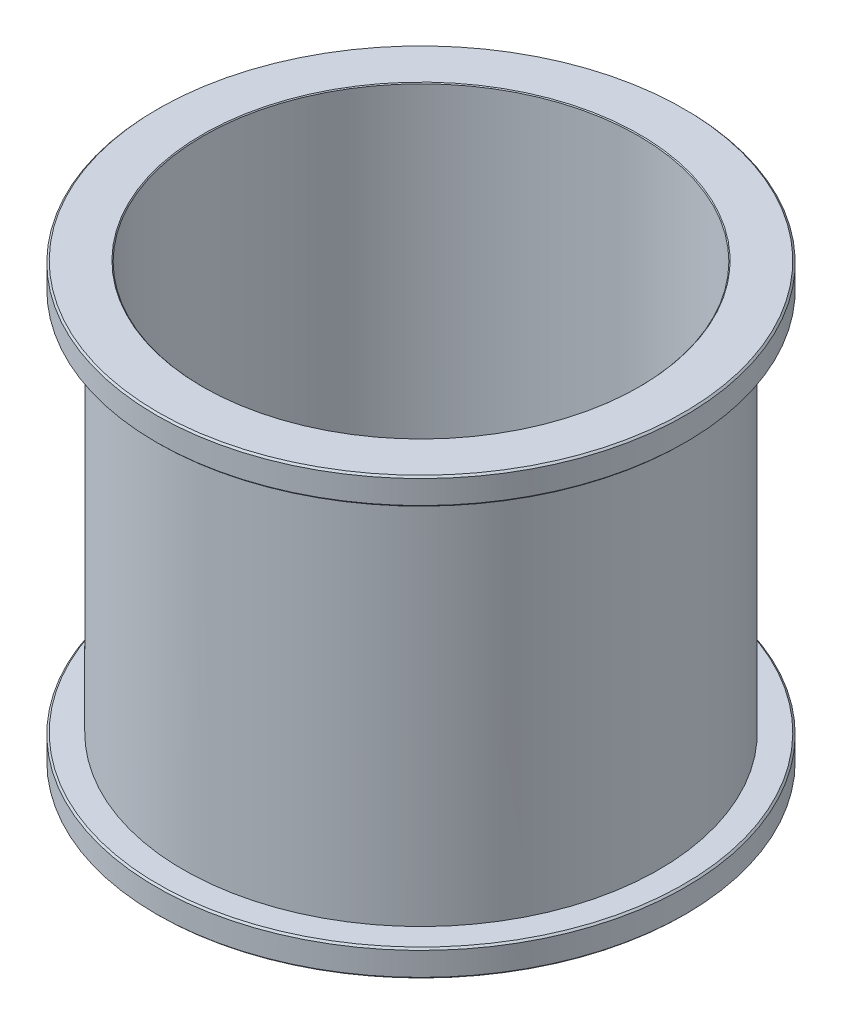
SolidWorks part; units mm, degrees
ref_plane "Front Plane" through (0, 0, 0) normal (0, 0, 1) x (1, 0, 0)
ref_plane "Top Plane" through (0, 0, 0) normal (0, 1, 0) x (1, 0, 0)
ref_plane "Right Plane" through (0, 0, 0) normal (1, 0, 0) x (0, 0, -1)
sketch "Sketch1" plane through (0, 0, 0) normal (0, 1, 0) x (1, 0, 0)
  circle A0 centre (0, 0) radius 71
  circle A1 centre (0, 0) radius 65
  dimension "D1" = 142
  dimension "D2" = 130
extrude "tube" add sketch "Sketch1" along normal blind 130
sketch "Sketch2" plane through (0, 130, 0) normal (0, 1, 0) x (1, 0, 0)
  circle A0 centre (0, 0) radius 79
  circle A1 centre (0, 0) radius 71 construction
  circle A2 centre (0, 0) radius 71
  dimension "D1" = 158
extrude "top flange" add sketch "Sketch2" against normal blind 8
sketch "Sketch3" plane through (0, 0, 0) normal (0, -1, 0) x (1, 0, 0)
  circle A0 centre (0, 0) radius 79 construction
  circle A1 centre (0, 0) radius 71 construction
  circle A2 centre (0, 0) radius 71
  circle A3 centre (0, 0) radius 79
extrude "bottom flange" add sketch "Sketch3" against normal blind 8
chamfer "Chamfer2" distance 0.508 angle 45 4 edges at (0, 8, -79) (0, 0, -79) (0, 122, 79) (0, 130, 79)
chamfer "Chamfer3" distance 0.254 angle 45 2 edges at (0, 0, 65) (0, 130, 65)
